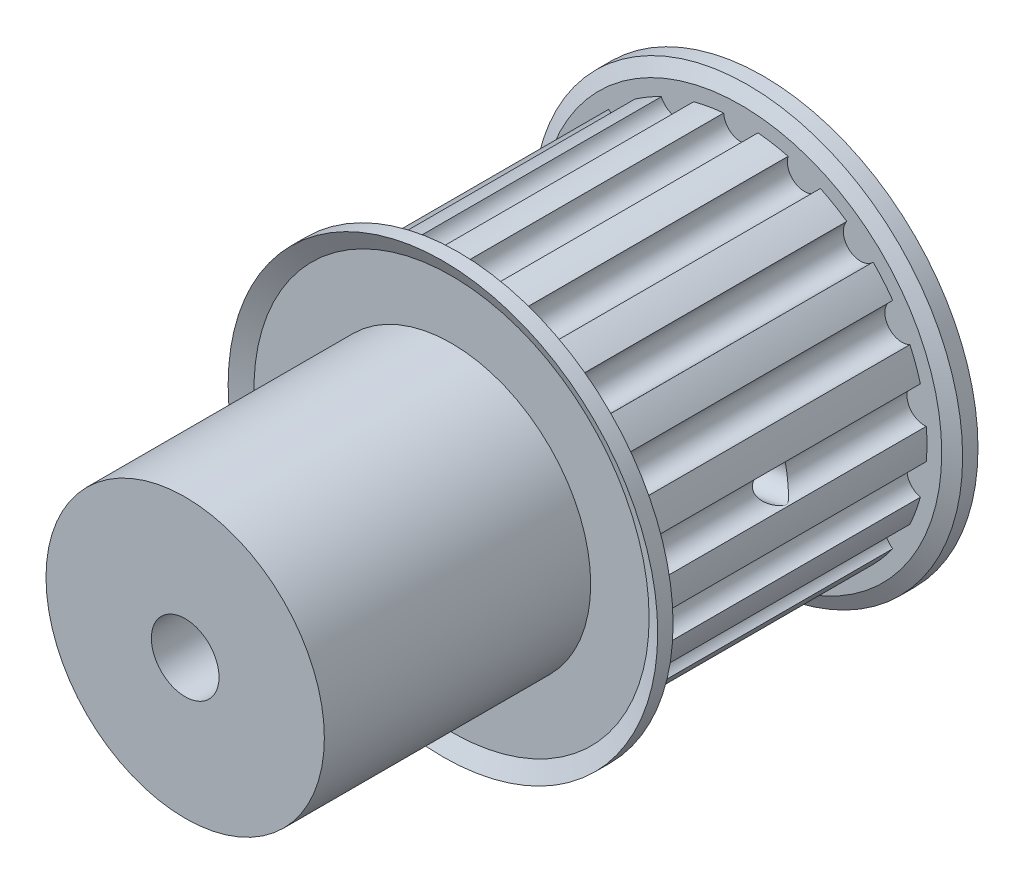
SolidWorks part; units mm, degrees
ref_plane "Front" through (0, 0, 0) normal (0, 0, 1) x (1, 0, 0)
ref_plane "Top" through (0, 0, 0) normal (0, 1, 0) x (1, 0, 0)
ref_plane "Right" through (0, 0, 0) normal (1, 0, 0) x (0, 0, -1)
sketch "Sketch2" plane through (0, 0, 0) normal (1, 0, 0) x (0, 0, -1)
  line L0 (-32.0215, 0) -> (12.9614, 0) construction
  line L1 (-30.8864, 0) -> (-30.8864, 10.287)
  line L2 (-30.8864, 10.287) -> (-11.2014, 10.287)
  line L3 (-11.2014, 10.287) -> (-11.2014, 14.605)
  line L4 (11.2014, 14.605) -> (11.2014, 10.287)
  line L5 (0, 21.2968) -> (0, 6.2114) construction
  line L6 (-11.8364, 15.875) -> (-10.7005, 15.875)
  line L7 (11.8364, 15.875) -> (10.7005, 15.875)
  line L8 (-30.8864, 0) -> (11.8364, 0)
  line L9 (-10.1854, 14.8448) -> (-10.1854, 13.7541)
  line L10 (-10.1854, 13.7541) -> (10.1854, 13.7541)
  line L11 (10.1854, 14.8448) -> (10.1854, 13.7541)
  line L12 (10.1854, 14.8448) -> (10.7005, 15.875)
  line L13 (11.8364, 10.287) -> (11.8364, 0)
  line L14 (11.2014, 14.605) -> (11.8364, 15.875)
  line L15 (-11.2014, 14.605) -> (-11.8364, 15.875)
  line L16 (-10.7005, 15.875) -> (-10.1854, 14.8448)
  line L18 (11.2014, 10.287) -> (11.8364, 10.287)
  point P9 (0, 13.7541)
  dimension "D8" = 1.016
  dimension "D9" = 42.7228
  dimension "D1" = 20.574
  dimension "D2" = 23.6728
  dimension "D3" = 27.5082
  dimension "D4" = 1.651
  dimension "D5" = 19.05
  dimension "D6" = 20.574
  dimension "D7" = 1.016
  dimension "D11" = 1.016
  dimension "D12" = 31.75
  dimension "D13" = 20.3708
  dimension "D14" = 2.1209
  dimension "D15" = 3.4671
  dimension "D16" = 1.651
  dimension "D17" = 1.016
  dimension "D18" = 29.21
  dimension "D19" = 20.701
revolve "Base-Revolve" add sketch "Sketch2" angle 360 about L0
ref_plane "Plane1" through (0, -13.7541, 0) normal (0, -1, 0) x (1, 0, 0)
hole_wizard "M3x0.5 Tapped Hole1" positions "Sketch6" profile "Sketch5" tap size "M3x0.5" standard "ANSI Metric"
sketch "Sketch6" plane through (0, -13.7541, 0) normal (0, -1, 0) x (1, 0, 0)
  point P0 (0, 0)
sketch "Sketch5" plane through (0, -13.7541, 0) normal (1, 0, 0) x (0, 0, -1)
  line L0 (0, 0) -> (0, 10.4031)
  line L1 (0, 10.4031) -> (1.25, 9.652)
  line L2 (1.25, 9.652) -> (1.25, 0)
  line L5 (1.25, 0) -> (0, 0)
  line L10 (0, 10.4031) -> (-1.25, 9.652) construction
  line L11 (0, -6.35) -> (0, 107.95) construction
  dimension "Tap Drill Dia." = 2.5
  dimension "Tap Drill Depth" = 9.652
  dimension "Drill Angle" = 118
pattern_circular "CirPattern2" count 2 over 100 about axis through (0, 0, 30.8864) along (0, 0, 1) of "M3x0.5 Tapped Hole1"
sketch "Sketch4" plane through (0, 0, 10.1854) normal (0, 0, 1) x (1, 0, 0)
  line L0 (-10.9038, 0) -> (10.6522, 0) construction
  line L1 (0, 0) -> (0, 14.922) construction
  circle A0 centre (0, 0) radius 13.7541 construction
  arc A1 (-1.2686, 13.6955) -> (1.2686, 13.6955) centre (0, 13.7541) ccw
  arc A5 (1.2686, 13.6955) -> (-1.2686, 13.6955) centre (0, 0) ccw
  dimension "D2" = 1.27
extrude "Cut-Extrude2" cut sketch "Sketch4" against normal up to surface (20.3708 mm away)
pattern_circular "CirPattern1" count 18 over 360 about axis through (0, 0, 0) along (0, 0, 1) of "Cut-Extrude2"
sketch "Sketch7" plane through (0, 0, 30.8864) normal (0, 0, 1) x (1, 0, 0)
  circle A0 centre (0, 0) radius 2.5
  dimension "D1" = 5
extrude "Cut-Extrude3" cut sketch "Sketch7" against normal through all
sketch "Sketch8" plane through (0, 0, 0) normal (1, 0, 0) x (0, 0, -1)
  line L0 (-11.2014, 10.287) -> (-30.8864, 10.287) construction
  line L1 (-11.8364, 15.875) -> (-10.1854, 15.875)
  line L2 (-11.8364, 15.875) -> (-11.8364, 10.287)
  line L3 (-11.8364, 10.287) -> (-10.1854, 10.287)
  line L4 (-10.1854, 15.875) -> (-10.1854, 10.287)
  line L7 (-10.1854, -14.8448) -> (-10.1854, 14.8448) construction
  line L8 (11.8364, 10.287) -> (11.2014, 10.287) construction
  line L9 (10.1854, 15.875) -> (11.8364, 15.875)
  line L10 (10.1854, 15.875) -> (10.1854, 10.287)
  line L11 (10.1854, 10.287) -> (11.8364, 10.287)
  line L12 (11.8364, 15.875) -> (11.8364, 10.287)
  line L13 (10.1854, 14.8448) -> (10.1854, -14.8448) construction
  line L14 (-36.5919, 0) -> (23.9371, 0) construction
revolve "Flange Machine detail" [suppressed] cut sketch "Sketch8" angle 360 about L14
